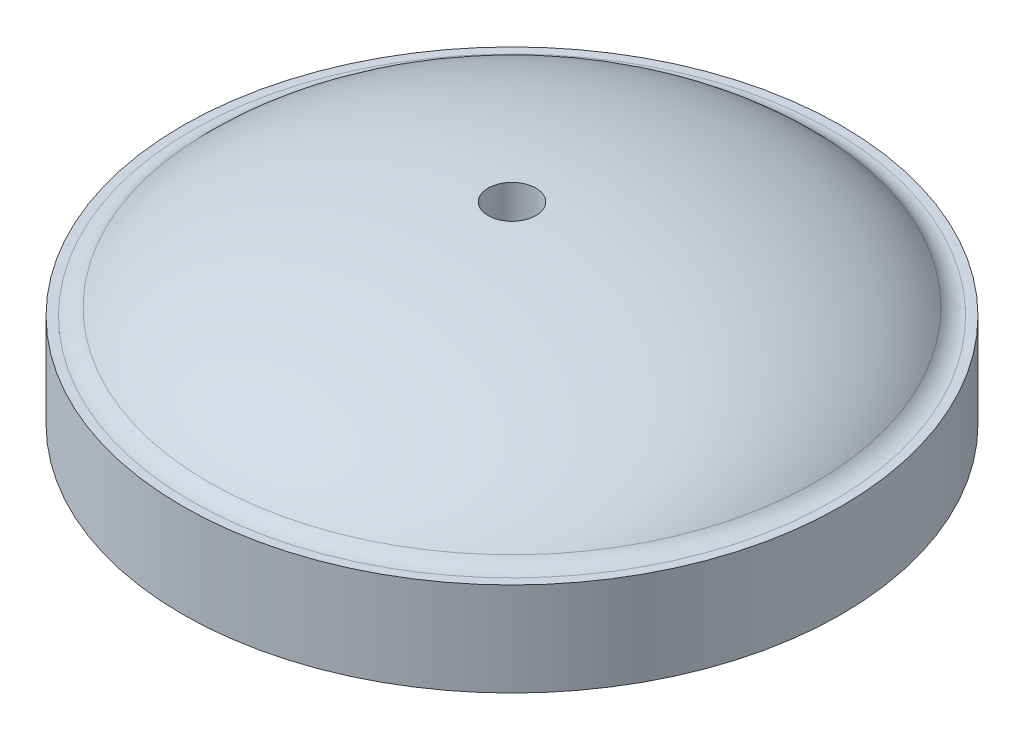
SolidWorks part; units mm, degrees
ref_plane "Plane1" through (0, 0, 0) normal (0, 0, 1) x (1, 0, 0)
ref_plane "Plane2" through (0, 0, 0) normal (0, 1, 0) x (1, 0, 0)
ref_plane "Plane3" through (0, 0, 0) normal (1, 0, 0) x (0, 0, -1)
sketch "Sketch2" plane through (0, 0, 0) normal (0, 0, 1) x (1, 0, 0)
  line L0 (-92.202, 0) -> (106.172, 0) construction
  line L1 (0, 86.36) -> (0, -75.946) construction
  line L2 (13.335, 35.4691) -> (13.335, 5.9944)
  line L4 (8.2296, 6.5024) -> (12.7, 6.5024) construction
  line L5 (71.5, 11.2598) -> (71.5, 5.9944)
  line L6 (71.5, 6.5024) -> (78.74, 6.5024) construction
  line L8 (82.55, -11.2776) -> (82.55, 5.9944)
  line L11 (3.556, 5.9944) -> (2.7541, 39.9802)
  line L15 (2.65, 40.9956) -> (12.7, 40.9956) construction
  line L17 (13.335, 5.9944) -> (3.556, 5.9944)
  line L18 (85.3038, 13.6144) -> (87.63, 13.6144)
  line L19 (82.55, 6.246) -> (82.55, -20.574) construction
  line L20 (82.55, -11.2776) -> (87.63, -11.2776)
  line L21 (71.5, 5.9944) -> (82.55, 5.9944)
  line L30 (87.63, 13.6144) -> (87.63, -11.2776)
  arc A0 (71.5, 11.2598) -> (64.8536, 22.4242) centre (58.8, 11.2598) ccw
  arc A10 (80.6552, 15.6385) -> (85.3038, 13.6144) centre (85.3038, 19.9644) ccw
  ellipse E0 centre (0, 0) end of major axis (87.63, 0) minor radius 40 (80.6552, 15.6385) -> (2.7541, 39.9802) ccw
  ellipse E2 centre (0, 0) end of major axis (82.9945, 0) minor radius 35.936 (64.8536, 22.4242) -> (13.335, 35.4691) ccw
  point P59 (2.413, 30.0736)
  point P63 (3.556, 21.2344)
  dimension "D11" = 12.7
  dimension "D36" = 6.35
  dimension "D1" = 40
  dimension "D4" = 165.989
  dimension "D5" = 6.5024
  dimension "D6" = 4.064
  dimension "D7" = 143
  dimension "D8" = 5.08
  dimension "D12" = 5.2654
  dimension "D13" = 29.4747
  dimension "D16" = 40.9956
  dimension "D17" = 5.3
  dimension "D21" = 82.55
  dimension "D22" = 17.78
  dimension "D24" = 0.508
  dimension "D27" = 34.4932
  dimension "D28" = 26.67
  dimension "D30" = 15.24
  dimension "D34" = 7.112
revolve "Base-Revolve" add sketch "Sketch2" angle 360 about L1
ref_plane "Plane7" through (0, 7.5184, 0) normal (0, -1, 0) x (1, 0, 0)
sketch "Sketch3" plane through (0, 5.9944, 0) normal (0, -1, 0) x (1, 0, 0)
  line L0 (-47.3781, 53.5496) -> (-5.2494, 12.2583)
  line L3 (-78.4852, 76.9253) -> (77.1932, -75.659) construction
  line L16 (-54.4898, 46.2937) -> (-12.3612, 5.0023)
  arc A2 (-5.2494, 12.2583) -> (-12.3612, 5.0023) centre (0, 0) ccw
  circle A4 centre (0, 0) radius 13.335 construction
  circle A8 centre (0, 0) radius 71.5 construction
  arc A9 (-54.4898, 46.2937) -> (-47.3781, 53.5496) centre (0, 0) cw
  dimension "D1" = 10.16
extrude "Ribs Extrude" add sketch "Sketch3" against normal up to surface (12.2522 mm away)
pattern_circular "CirPattern1" count 5 over 360 about axis through (0, 0, 0) along (0, 1, 0) of "Ribs Extrude"
sketch "Sketch6" plane through (0, 5.9944, 0) normal (0, -1, 0) x (1, 0, 0)
  circle A1 centre (0, 0) radius 6.35
extrude "Cut-Extrude1" cut sketch "Sketch6" against normal through all
